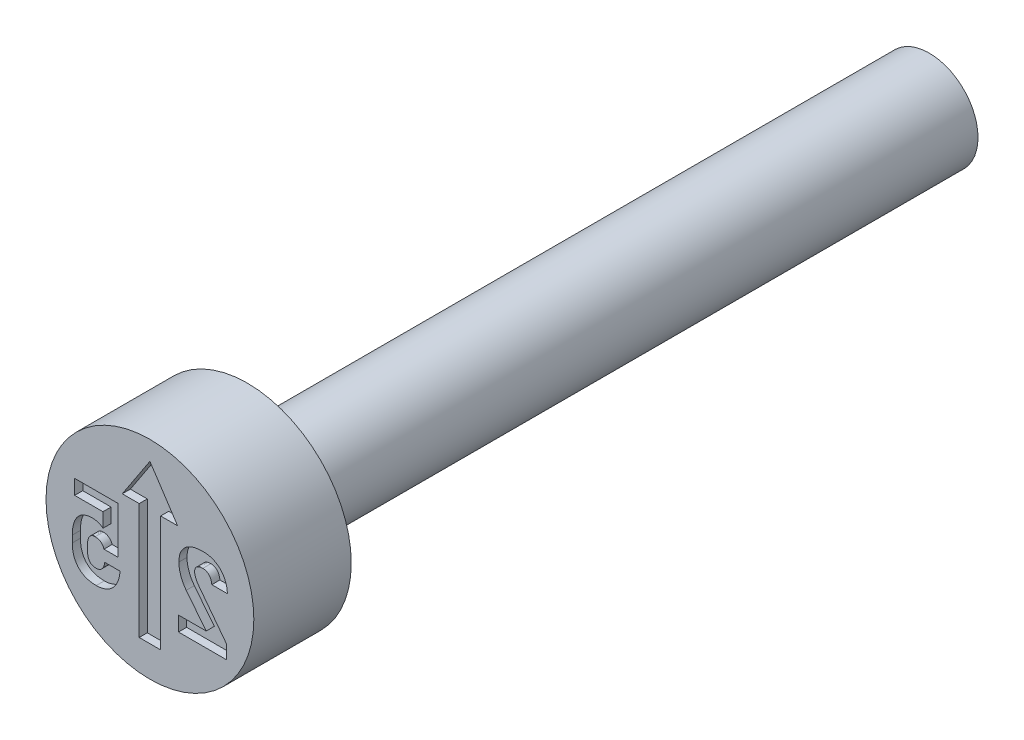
SolidWorks part; units mm, degrees
ref_plane "Front Plane" through (0, 0, 0) normal (0, 0, 1) x (1, 0, 0)
ref_plane "Top Plane" through (0, 0, 0) normal (0, 1, 0) x (1, 0, 0)
ref_plane "Right Plane" through (0, 0, 0) normal (1, 0, 0) x (0, 0, -1)
imported_body "Imported1"
sketch "Sketch1" plane through (0, 0, -0.569) normal (0, 0, 1) x (1, 0, 0)
  line L7 (0.8513, 1.3208) -> (0, 2.613)
  line L8 (0, 2.613) -> (-0.8513, 1.3208)
  line L9 (-0.8513, 1.3208) -> (-0.33, 1.3208)
  line L10 (-0.33, 1.3208) -> (-0.33, -2.25)
  line L11 (-0.33, -2.25) -> (0.33, -2.25)
  line L12 (0.33, -2.25) -> (0.33, 1.3208)
  line L13 (0.33, 1.3208) -> (0.8513, 1.3208)
  line L14 (0.8513, 1.3208) -> (0, 2.613)
  line L15 (0, 2.613) -> (-0.8513, 1.3208)
  line L16 (-0.8513, 1.3208) -> (-0.33, 1.3208)
  line L17 (-0.33, 1.3208) -> (-0.33, -2.25)
  line L18 (-0.33, -2.25) -> (0.33, -2.25)
  line L19 (0.33, -2.25) -> (0.33, 1.3208)
  line L20 (0.33, 1.3208) -> (0.8513, 1.3208)
  dimension "D1" = 0
sketch "Sketch3" plane through (0, 0, 0) normal (0, 1, 0) x (1, 0, 0)
  line L0 (1.75, 24) -> (-1.75, 24) construction
  line L1 (1.5, 24) -> (1.75, 24)
  line L2 (1.5, 24) -> (1.5, 3)
  line L3 (1.5, 3) -> (1.75, 3)
  line L4 (1.75, 24) -> (1.75, 3)
  line L5 (3.2, 3) -> (-3.2, 3) construction
  line L6 (0, 24) -> (0, 25.7321) construction
  dimension "D1" = 3
  dimension "D2" = 0.25
revolve "Cut-Revolve1" cut sketch "Sketch3" angle 360 about L6
sketch "Sketch2" plane through (0, 0, 0) normal (0, 0, 1) x (1, 0, 0)
  text T0 "2  5" font "Bahnschrift" height 2.5
  dimension "D1" = 1.5
extrude "Cut-Extrude2" cut sketch "Sketch2" against normal blind 0.25
extrude "Boss-Extrude2" add sketch "Sketch1" along normal blind 0.32
